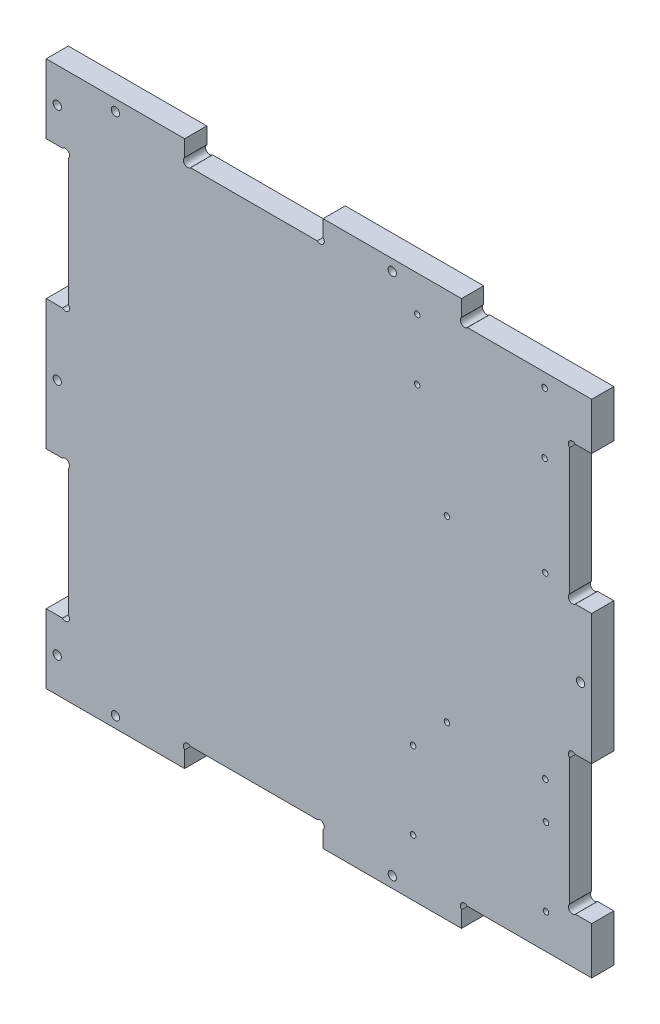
SolidWorks part; units mm, degrees
ref_plane "Plan de face" through (0, 0, 0) normal (0, 0, 1) x (1, 0, 0)
ref_plane "Plan de dessus" through (0, 0, 0) normal (0, 1, 0) x (1, 0, 0)
ref_plane "Plan de droite" through (0, 0, 0) normal (1, 0, 0) x (0, 0, -1)
sketch "Esquisse1" plane through (0, 0, 0) normal (0, 0, 1) x (1, 0, 0)
  line L0 (-37.7962, -47.0376) -> (-37.7962, -94.0376)
  line L1 (12.2038, -169.0376) -> (-29.7962, -169.0376)
  line L2 (-29.7962, -169.0376) -> (-37.7962, -169.0376)
  line L3 (-37.7962, -169.0376) -> (-37.7962, -144.0376)
  line L4 (-29.7962, 2.9624) -> (-37.7962, 27.9624) construction
  line L5 (12.2038, 19.9624) -> (-37.7962, 27.9624) construction
  line L6 (112.2038, 27.9624) -> (62.2038, 19.9624) construction
  line L7 (159.2038, 2.9624) -> (153.3251, 2.9624)
  line L8 (-31.9175, -47.0376) -> (-37.7962, -47.0376)
  line L9 (62.2038, 27.9624) -> (112.2038, 27.9624)
  line L10 (151.2038, 0.8411) -> (151.2038, -44.9163)
  line L11 (153.3251, -47.0376) -> (159.2038, -47.0376)
  line L12 (159.2038, -94.0376) -> (153.3251, -94.0376)
  line L13 (-37.7962, -144.0376) -> (-31.9175, -144.0376)
  line L14 (12.2038, -163.1589) -> (12.2038, -169.0376)
  line L15 (60.0825, -161.0376) -> (14.3251, -161.0376)
  line L16 (62.2038, -169.0376) -> (62.2038, -163.1589)
  line L17 (-29.7962, -96.1589) -> (-29.7962, -141.9163)
  line L18 (112.2038, -163.1589) -> (112.2038, -169.0376)
  line L19 (159.2038, -161.0376) -> (114.3251, -161.0376)
  line L20 (151.2038, -96.1589) -> (151.2038, -141.9163)
  line L21 (153.3251, -144.0376) -> (159.2038, -144.0376)
  line L22 (159.2038, -47.0376) -> (159.2038, -94.0376)
  line L23 (62.2038, -169.0376) -> (112.2038, -169.0376)
  line L24 (159.2038, 19.9624) -> (114.3251, 19.9624)
  line L25 (112.2038, 22.0837) -> (112.2038, 27.9624)
  line L26 (-29.7962, -44.9163) -> (-29.7962, 0.8411)
  line L27 (112.2038, -169.0376) -> (62.2038, -161.0376) construction
  line L28 (62.2038, 27.9624) -> (62.2038, 22.0837)
  line L29 (-31.9175, -94.0376) -> (-37.7962, -94.0376)
  line L30 (159.2038, 19.9624) -> (159.2038, 2.9624)
  line L31 (60.0825, 19.9624) -> (14.3251, 19.9624)
  line L32 (12.2038, 22.0837) -> (12.2038, 27.9624)
  line L33 (12.2038, -161.0376) -> (-37.7962, -169.0376) construction
  line L34 (-29.7962, -144.0376) -> (-37.7962, -169.0376) construction
  line L35 (-37.7962, 2.9624) -> (-31.9175, 2.9624)
  line L36 (-37.7962, 27.9624) -> (-37.7962, 2.9624)
  line L37 (-29.7962, 27.9624) -> (-37.7962, 27.9624)
  line L38 (12.2038, 27.9624) -> (-29.7962, 27.9624)
  line L40 (-51.1241, -70.5376) -> (276.9939, -70.5376) construction
  line L42 (159.2038, -144.0376) -> (159.2038, -161.0376)
  line L43 (151.2038, -47.0376) -> (159.2038, -94.0376) construction
  line L44 (151.2038, 2.9624) -> (171.307, -17.1408) construction
  line L45 (151.2038, -47.0376) -> (164.4403, -33.8011) construction
  line L46 (151.2038, -94.0376) -> (163.5132, -106.347) construction
  line L47 (151.2038, -144.0376) -> (163.9558, -131.2857) construction
  circle A0 centre (155.2038, -70.5376) radius 1.5
  circle A1 centre (-33.7962, 15.4624) radius 1.5
  circle A2 centre (-12.7962, 23.9624) radius 1.5
  circle A3 centre (87.2038, 23.9624) radius 1.5
  arc A4 (12.2038, -163.1589) -> (14.3251, -161.0376) centre (13.2645, -162.0983) cw
  arc A5 (60.0825, -161.0376) -> (62.2038, -163.1589) centre (61.1432, -162.0983) cw
  arc A6 (112.2038, -163.1589) -> (114.3251, -161.0376) centre (113.2645, -162.0983) cw
  arc A7 (153.3251, 2.9624) -> (151.2038, 0.8411) centre (152.2645, 1.9017) ccw
  arc A8 (151.2038, -44.9163) -> (153.3251, -47.0376) centre (152.2645, -45.9769) ccw
  arc A9 (-31.9175, -144.0376) -> (-29.7962, -141.9163) centre (-30.8568, -142.9769) ccw
  arc A10 (-29.7962, -96.1589) -> (-31.9175, -94.0376) centre (-30.8568, -95.0983) ccw
  arc A11 (-29.7962, -44.9163) -> (-31.9175, -47.0376) centre (-30.8568, -45.9769) cw
  arc A12 (153.3251, -94.0376) -> (151.2038, -96.1589) centre (152.2645, -95.0983) ccw
  circle A13 centre (87.2038, -165.0376) radius 1.5
  circle A14 centre (-12.7962, -165.0376) radius 1.5
  circle A15 centre (-33.7962, -156.5376) radius 1.5
  arc A16 (151.2038, -141.9163) -> (153.3251, -144.0376) centre (152.2645, -142.9769) ccw
  arc A17 (-31.9175, 2.9624) -> (-29.7962, 0.8411) centre (-30.8568, 1.9017) cw
  circle A18 centre (142.2038, 15.0634) radius 1
  arc A19 (112.2038, 22.0837) -> (114.3251, 19.9624) centre (113.2645, 21.0231) ccw
  arc A20 (60.0825, 19.9624) -> (62.2038, 22.0837) centre (61.1432, 21.0231) ccw
  arc A21 (12.2038, 22.0837) -> (14.3251, 19.9624) centre (13.2645, 21.0231) ccw
  circle A22 centre (-33.7962, -70.5376) radius 1.5
  circle A23 centre (142.2038, -6.9366) radius 1
  circle A24 centre (96.2038, -6.9366) radius 1
  circle A25 centre (96.2038, 15.0634) radius 1
  circle A26 centre (142.4538, -42.6866) radius 1
  circle A27 centre (106.9538, -42.6866) radius 1
  circle A28 centre (142.4538, -107.1866) radius 1
  circle A29 centre (106.9538, -107.1866) radius 1
  circle A30 centre (142.7038, -120.5376) radius 1
  circle A31 centre (94.7038, -120.5376) radius 1
  circle A32 centre (94.7038, -148.5376) radius 1
  circle A33 centre (142.7038, -148.5376) radius 1
  point P95 (-37.7962, -70.5376)
  dimension "D1" = 45
  dimension "D5" = 50
  dimension "D2" = 45
  dimension "D3" = 45
  dimension "D4" = 45
  dimension "D6" = 50
  dimension "D7" = 50
  dimension "D8" = 8
  dimension "D9" = 47
extrude "Boss.-Extru.1" add sketch "Esquisse1" along normal blind 8
